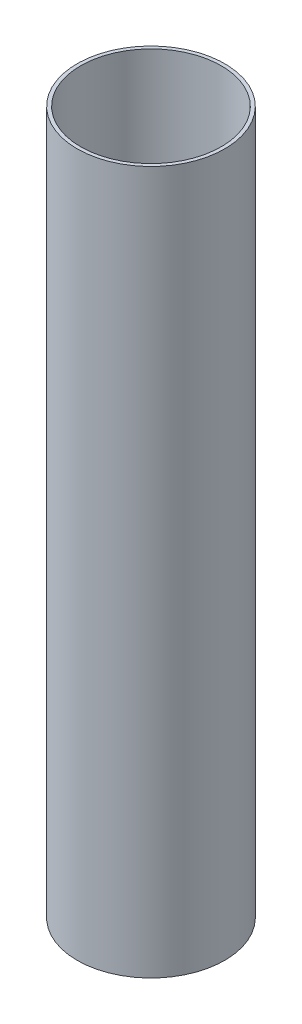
SolidWorks part; units mm, degrees
ref_plane "Plan de face" through (0, 0, 0) normal (0, 0, 1) x (1, 0, 0)
ref_plane "Plan de dessus" through (0, 0, 0) normal (0, 1, 0) x (1, 0, 0)
ref_plane "Plan de droite" through (0, 0, 0) normal (1, 0, 0) x (0, 0, -1)
sketch "Esquisse1" plane through (0, 0, 0) normal (0, 1, 0) x (1, 0, 0)
  circle A0 centre (0, 0) radius 20
  circle A1 centre (0, 0) radius 21
  dimension "D1" = 40
  dimension "D2" = 42
extrude "Boss.-Extru.1" add sketch "Esquisse1" along normal blind 200
